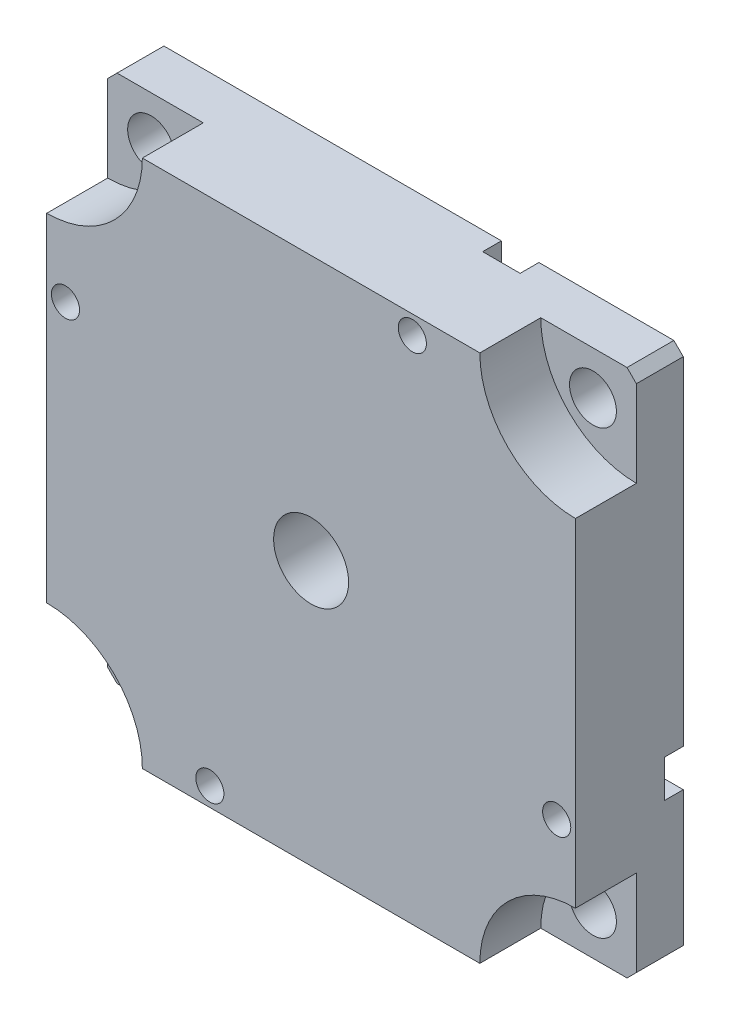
SolidWorks part; units mm, degrees
ref_plane "前视" through (0, 0, 0) normal (0, 0, 1) x (1, 0, 0)
ref_plane "上视" through (0, 0, 0) normal (0, 1, 0) x (1, 0, 0)
ref_plane "右视" through (0, 0, 0) normal (1, 0, 0) x (0, 0, -1)
sketch "草图1" plane through (0, 0, 0) normal (0, 0, 1) x (1, 0, 0)
  line L0 (-28.2, 27.2) -> (-27.2, 28.2)
  line L1 (27.2, -28.2) -> (-27.2, -28.2)
  line L2 (28.2, -27.2) -> (28.2, 27.2)
  line L3 (27.2, 28.2) -> (-27.2, 28.2)
  line L4 (-28.2, -27.2) -> (-28.2, 27.2)
  line L5 (28.2, -28.2) -> (-28.2, 28.2) construction
  line L6 (28.2, 28.2) -> (-28.2, -28.2) construction
  line L13 (28.2, 27.2) -> (27.2, 28.2)
  line L14 (28.2, -27.2) -> (27.2, -28.2)
  line L15 (-28.2, -27.2) -> (-27.2, -28.2)
  point P0 (0, 0)
  dimension "D1" = 56.4
  dimension "D2" = 56.4
extrude "凸台-拉伸1" add sketch "草图1" along normal blind 5
sketch "草图2" plane through (0, 0, 0) normal (0, 0, -1) x (-1, 0, 0)
  line L5 (23.57, -23.57) -> (-23.57, 23.57) construction
  line L6 (23.57, 23.57) -> (-23.57, -23.57) construction
  circle A0 centre (-23.57, 23.57) radius 2.5
  circle A1 centre (23.57, 23.57) radius 2.5
  circle A2 centre (-23.57, -23.57) radius 2.5
  circle A3 centre (23.57, -23.57) radius 2.5
  point P0 (0, 0)
  dimension "D1" = 47.14
  dimension "D2" = 47.14
extrude "切除-拉伸1" cut sketch "草图2" against normal blind 5
sketch "草图3" plane through (0, 0, 5) normal (0, 0, 1) x (1, 0, 0)
  line L0 (27.2, 28.2) -> (-27.2, 28.2) construction
  line L1 (18, -28.2) -> (-18, -28.2)
  line L3 (18, 28.2) -> (-18, 28.2)
  line L5 (18, -28.2) -> (-18, 28.2) construction
  line L6 (18, 28.2) -> (-18, -28.2) construction
  line L7 (-28.2, 27.2) -> (-28.2, -27.2) construction
  line L9 (28.2, -18) -> (28.2, 18)
  line L11 (-28.2, -18) -> (-28.2, 18)
  line L12 (28.2, -18) -> (-28.2, 18) construction
  line L13 (28.2, 18) -> (-28.2, -18) construction
  arc A0 (-28.2, 18) -> (-18, 28.2) centre (-28.2, 28.2) ccw
  arc A1 (28.2, 18) -> (18, 28.2) centre (28.2, 28.2) cw
  arc A2 (28.2, -18) -> (18, -28.2) centre (28.2, -28.2) ccw
  arc A3 (-28.2, -18) -> (-18, -28.2) centre (-28.2, -28.2) cw
  point P0 (0, 0)
  point P8 (0, 0)
  dimension "D1" = 36
  dimension "D2" = 36
extrude "凸台-拉伸2" add sketch "草图3" along normal blind 6.5
sketch "草图4" plane through (0, 0, 0) normal (0, 0, -1) x (-1, 0, 0)
  circle A0 centre (0, 0) radius 19.05
  circle A1 centre (0, 0) radius 19.55
extrude "切除-拉伸2" cut sketch "草图4" against normal blind 1
sketch "草图5" plane through (0, 0, 0) normal (0, 0, -1) x (-1, 0, 0)
  circle A0 centre (0, 0) radius 19.05
extrude "凸台-拉伸3" add sketch "草图5" along normal blind 1.6
sketch "草图6" plane through (0, 0, -1.6) normal (0, 0, -1) x (-1, 0, 0)
  circle A0 centre (0, 0) radius 4
extrude "切除-拉伸3" cut sketch "草图6" against normal blind 20
sketch "草图10" plane through (0, 0, 0) normal (0, 0, -1) x (-1, 0, 0)
  line L0 (-12.8, 26.2) -> (-12.8, 28.2)
  line L4 (-27.2, 28.2) -> (27.2, 28.2) construction
  line L5 (-8.8, 26.2) -> (-8.8, 28.2)
  line L6 (-12.8, 28.2) -> (-8.8, 28.2)
  arc A0 (-12.8, 26.2) -> (-8.8, 26.2) centre (-10.8, 26.2) ccw
  dimension "D1" = 4
extrude "切除-拉伸4" cut sketch "草图10" against normal blind 2
pattern_circular "阵列(圆周)1" count 4 over 360 about axis through (0, 0, 0) along (0, 0, 1) of "切除-拉伸4"
sketch "草图12" plane through (0, 0, 0) normal (0, 0, -1) x (-1, 0, 0)
  circle A0 centre (-10.8, 26.2) radius 1.5
extrude "切除-拉伸5" cut sketch "草图12" against normal blind 50
pattern_circular "阵列(圆周)2" count 4 over 360 about axis through (0, 0, 0) along (0, 0, 1) of "切除-拉伸5"
